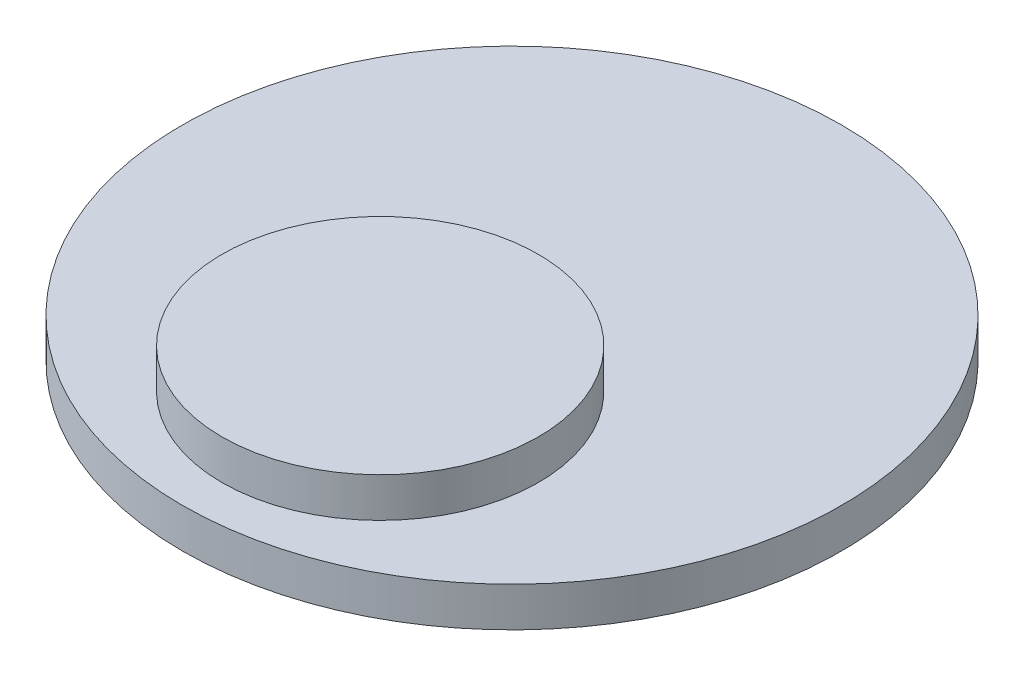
SolidWorks part; units mm, degrees
ref_plane "Front Plane" through (0, 0, 0) normal (0, 0, 1) x (1, 0, 0)
ref_plane "Top Plane" through (0, 0, 0) normal (0, 1, 0) x (1, 0, 0)
ref_plane "Right Plane" through (0, 0, 0) normal (1, 0, 0) x (0, 0, -1)
sketch "Sketch1" plane through (0, 0, 0) normal (0, 1, 0) x (1, 0, 0)
  circle A0 centre (0, 0) radius 12.5
  dimension "D1" = 25
extrude "Boss-Extrude1" add sketch "Sketch1" along normal blind 1.5
sketch "Sketch2" plane through (0, 1.5, 0) normal (0, 1, 0) x (1, 0, 0)
  line L0 (0, -0.825) -> (0, 0.825) construction
  circle A0 centre (0, -5) radius 6
  dimension "D2" = 12
  dimension "D1" = 5
extrude "Boss-Extrude2" add sketch "Sketch2" along normal blind 1.5
